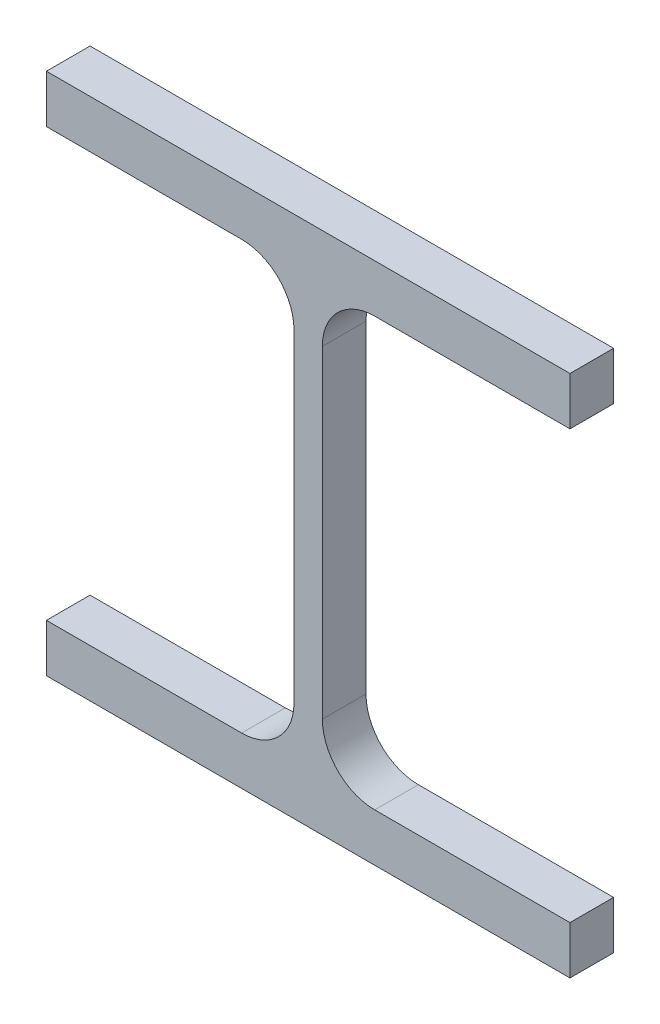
SolidWorks part; units mm, degrees
ref_plane "Alzado" through (0, 0, 0) normal (0, 0, 1) x (1, 0, 0)
ref_plane "Planta" through (0, 0, 0) normal (0, 1, 0) x (1, 0, 0)
ref_plane "Vista lateral" through (0, 0, 0) normal (1, 0, 0) x (0, 0, -1)
sketch "Croquis1" plane through (0, 0, 0) normal (0, 0, 1) x (1, 0, 0)
  line L0 (0, 60) -> (0, -60) construction
  line L1 (60, -60) -> (-60, -60)
  line L2 (-60, -60) -> (-60, -49)
  line L3 (-60, -49) -> (-15.25, -49)
  line L4 (-3.25, -37) -> (-3.25, 37)
  line L5 (-15.25, 49) -> (-60, 49)
  line L6 (-60, 49) -> (-60, 60)
  line L7 (-60, 60) -> (60, 60)
  line L8 (60, 49) -> (60, 60)
  line L9 (15.25, 49) -> (60, 49)
  line L10 (3.25, -37) -> (3.25, 37)
  line L11 (60, -49) -> (15.25, -49)
  line L12 (60, -60) -> (60, -49)
  arc A0 (-15.25, -49) -> (-3.25, -37) centre (-15.25, -37) ccw
  arc A1 (-3.25, 37) -> (-15.25, 49) centre (-15.25, 37) ccw
  arc A2 (3.25, 37) -> (15.25, 49) centre (15.25, 37) cw
  arc A3 (15.25, -49) -> (3.25, -37) centre (15.25, -37) cw
  dimension "D5" = 12
  dimension "D1" = 120
  dimension "D2" = 120
  dimension "D3" = 6.5
  dimension "D4" = 11
extrude "Saliente-Extruir1" add sketch "Croquis1" along normal blind 10
